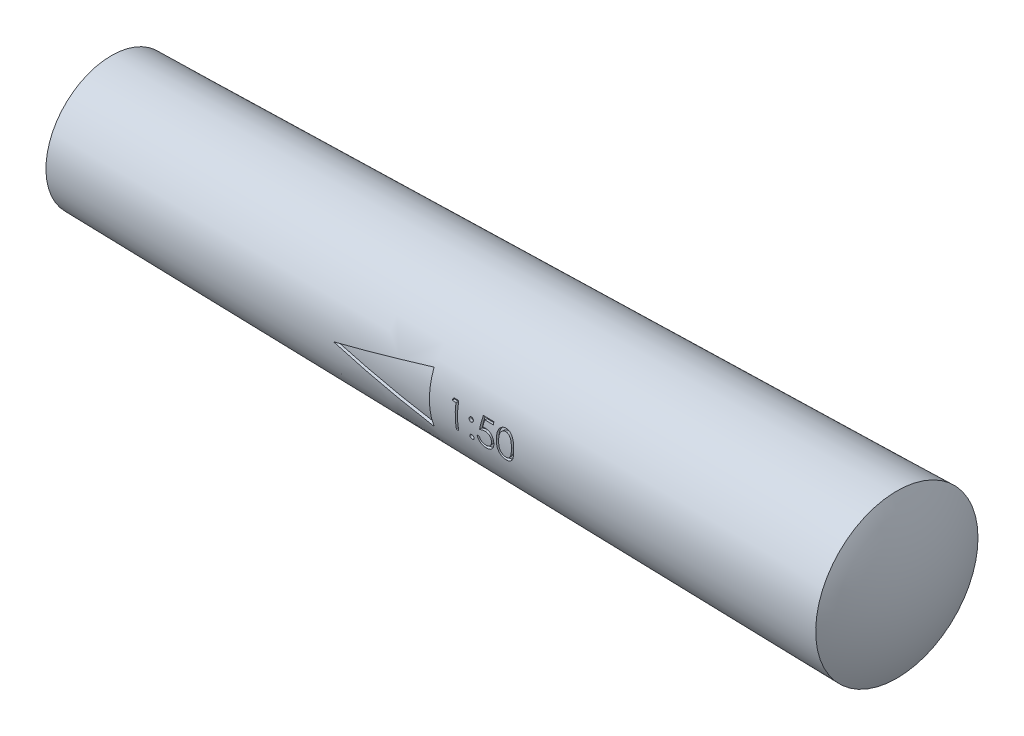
SolidWorks part; units mm, degrees
ref_plane "Front Plane" through (0, 0, 0) normal (0, 0, 1) x (1, 0, 0)
ref_plane "Top Plane" through (0, 0, 0) normal (0, 1, 0) x (1, 0, 0)
ref_plane "Right Plane" through (0, 0, 0) normal (1, 0, 0) x (0, 0, -1)
sketch "Sketch1" plane through (0, 0, 0) normal (1, 0, 0) x (0, 0, -1)
  circle A0 centre (0, 0) radius 2.5
  dimension "D1" = 5
extrude "Extrude1" add sketch "Sketch1" along normal mid plane 30
draft "Draft1" type of draft neutral plane draft angle 1.146 faces to draft 1 parameters "D1"=1.146
sketch "Sketch2" plane through (0, 0, 0) normal (0, 0, 1) x (1, 0, 0)
  line L0 (-15, 0) -> (-15, 2.5)
  line L1 (-15, 2.5) -> (-15, -2.5) construction
  line L2 (-15, 0) -> (-15.75, 0)
  line L3 (-15.75, 0) -> (-15.75, -2.8) construction
  line L4 (15, 0) -> (15, 3.1)
  line L5 (15, -3.1) -> (15, 3.1) construction
  line L6 (15, 0) -> (15.75, 0)
  line L7 (15.75, 0) -> (15.75, -2.8) construction
  line L8 (-15, -2.5) -> (15, -3.1) construction
  arc A0 (-15.75, 0) -> (-15, 2.5) centre (-11.2083, 0) cw
  arc A1 (15.75, 0) -> (15, 3.1) centre (8.9683, 0) ccw
  point P14 (0, -2.8)
revolve "Revolve1" add sketch "Sketch2" angle 360 about L2
sketch "Sketch5" plane through (0, 0, 0) normal (0, 0, 1) x (1, 0, 0)
  line L0 (0, 2.8) -> (0, -2.8) construction
  line L1 (15, 3.1) -> (-15, 2.5) construction
  line L2 (-15, -2.5) -> (15, -3.1) construction
ref_plane "Plane2" through (0, 0, 0) normal (-0.02, 0, 0.9998) x (0.9998, 0, 0.02)
sketch "Sketch6" plane through (0, 0, 0) normal (-0.02, 0, 0.9998) x (0.9998, 0, 0.02)
  line L0 (0, 0) -> (0, 1)
  line L1 (0, 2.8) -> (0, -2.8) construction
  line L2 (0, 1) -> (-3.7321, 0)
  line L3 (-3.7321, 0) -> (0, -1)
  line L4 (0, -1) -> (0, 0)
  line L5 (0, -0.5) -> (4, -0.5) construction
  text T0 "1:50" font "Century Gothic" height 1
  dimension "D1" = 2
  dimension "D2" = 30
  dimension "D3" = 4
wrap "Wrap2" sketch "Sketch6" wrap type deboss source sketch "Sketch6" thickness 0.1 parameters "D1"=0.1
equation "\"D2@Sketch2\" = \"D1@Sketch2\""
